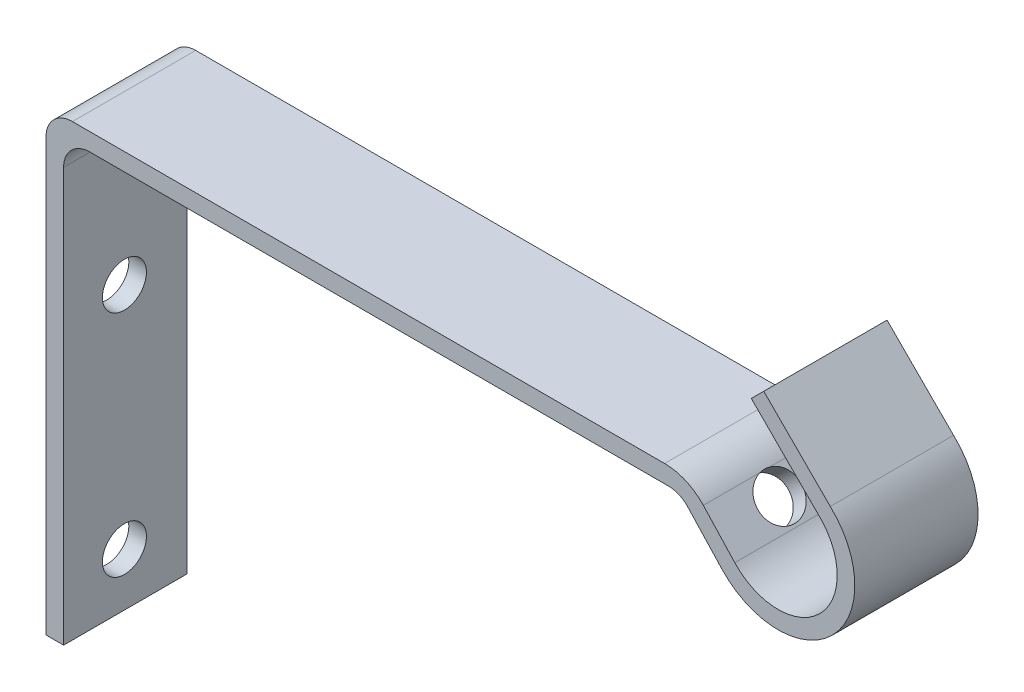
SolidWorks part; units mm, degrees
ref_plane "Alzado" through (0, 0, 0) normal (0, 0, 1) x (1, 0, 0)
ref_plane "Planta" through (0, 0, 0) normal (0, 1, 0) x (1, 0, 0)
ref_plane "Vista lateral" through (0, 0, 0) normal (1, 0, 0) x (0, 0, -1)
sketch "Croquis1" plane through (0, 0, 0) normal (0, 0, 1) x (1, 0, 0)
  line L0 (0, 0) -> (0, 50)
  line L1 (0, 50) -> (70, 50)
  line L2 (-2, 0) -> (-2, 52)
  line L3 (-2, 52) -> (70, 52)
  line L4 (-2, 0) -> (0, 0)
  line L5 (70, 50) -> (74.7621, 44.8695)
  line L6 (71.4659, 51.3606) -> (76.228, 46.2301)
  line L7 (85.6904, 55.7357) -> (78.106, 63.3202)
  line L8 (79.5202, 64.7344) -> (78.106, 63.3202)
  line L9 (87.077, 57.1775) -> (79.5202, 64.7344)
  line L10 (71.4659, 51.3606) -> (70.8724, 52)
  line L11 (70, 52) -> (70.8724, 52)
  arc A0 (74.7621, 44.8695) -> (87.077, 57.1775) centre (81.147, 50.796) ccw
  arc A1 (76.228, 46.2301) -> (85.6904, 55.7357) centre (81.147, 50.796) ccw
  dimension "D1" = 50
  dimension "D2" = 70
  dimension "D4" = 7
  dimension "D3" = 2
  dimension "D5" = 2
extrude "Extruir1" add sketch "Croquis1" along normal blind 14
fillet "Redondeo1" radius 6 1 edges at (70.8724, 52, 7)
fillet "Redondeo2" radius 3 1 edges at (-2, 52, 7)
fillet "Redondeo3" radius 3 1 edges at (0, 50, 7)
sketch "Croquis2" plane through (0, 0, 0) normal (1, 0, 0) x (0, 0, -1)
  line L0 (-14, 0) -> (0, 0) construction
  circle A0 centre (-7.0933, 6) radius 2.5
  circle A1 centre (-7.0933, 32) radius 2.5
  dimension "D1" = 5
  dimension "D2" = 5
  dimension "D3" = 26
  dimension "D4" = 6
extrude "Cortar-Extruir1" cut sketch "Croquis2" against normal through all
sketch "Croquis3" plane through (63.9995, 59.4045, 0) normal (0.7329, 0.6803, 0) x (0, 0, -1)
  line L0 (0, -17.3319) -> (0, -6.6523) construction
  circle A0 centre (-7, -15.1587) radius 2.5
  dimension "D1" = 5
  dimension "D2" = 7
extrude "Cortar-Extruir2" cut sketch "Croquis3" against normal through all
fillet "Redondeo4" radius 3 1 edges at (70, 50, 7)
